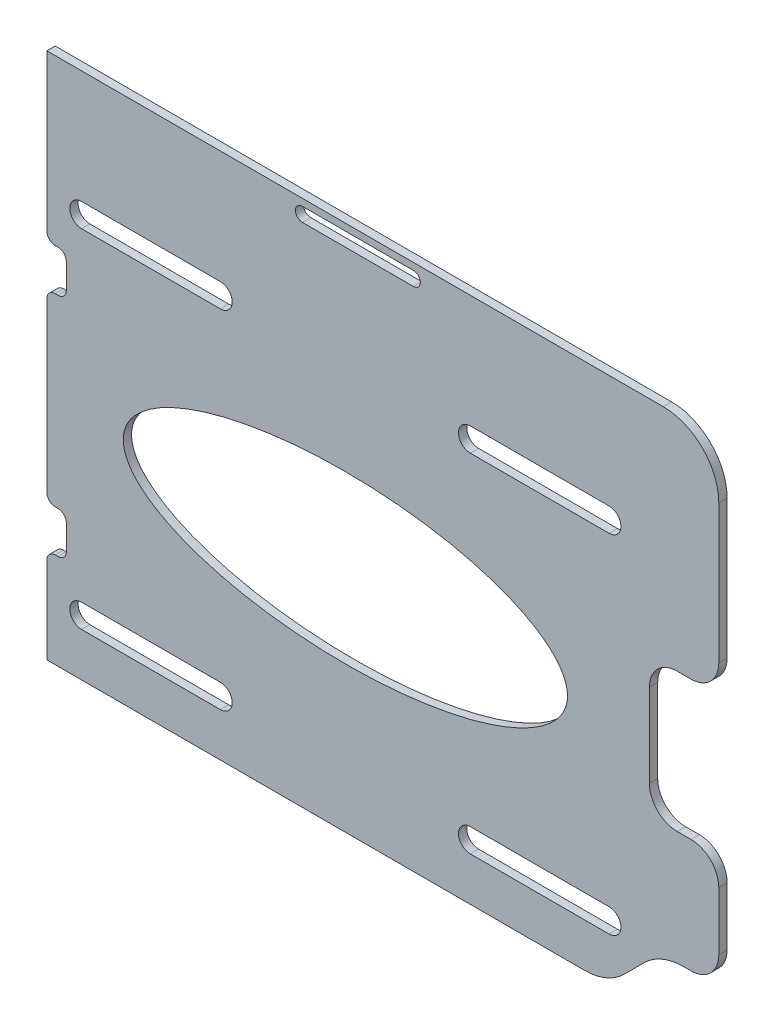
SolidWorks part; units mm, degrees
ref_plane "Plan1" through (0, 0, 0) normal (0, 0, 1) x (1, 0, 0)
ref_plane "Plan2" through (0, 0, 0) normal (0, 1, 0) x (1, 0, 0)
ref_plane "Plan3" through (0, 0, 0) normal (1, 0, 0) x (0, 0, -1)
sketch "Esquisse1" plane through (0, 0, 0) normal (0, 0, 1) x (1, 0, 0)
  line L0 (-95, 66.75) -> (-45, 66.75)
  line L1 (114.5, 107.5) -> (-107.5, 107.5)
  line L2 (-107.5, 107.5) -> (-107.5, 51.25)
  line L3 (-107.5, -82.5) -> (86.2157, -82.5)
  line L4 (134.5, 87.5) -> (134.5, 37.5)
  line L5 (-95, 58.25) -> (-45, 58.25)
  line L6 (45, 66.75) -> (95, 66.75)
  line L7 (45, 58.25) -> (95, 58.25)
  line L8 (-95, -58.25) -> (-45, -58.25)
  line L9 (-95, -66.75) -> (-45, -66.75)
  line L10 (45, -66.75) -> (95, -66.75)
  line L11 (45, -58.25) -> (95, -58.25)
  line L12 (-82.5, 84.25) -> (-82.5, 54.25) construction
  line L13 (-57.5, 84.25) -> (-57.5, 54.25) construction
  line L14 (57.5, 84.25) -> (57.5, 54.25) construction
  line L15 (82.5, 84.25) -> (82.5, 54.25) construction
  line L16 (100.3579, -76.6421) -> (107.6421, -69.3579)
  line L17 (109.5, 17.5) -> (109.5, -12.5)
  line L18 (119.5, 27.5) -> (124.5, 27.5)
  line L19 (119.5, -22.5) -> (124.5, -22.5)
  line L20 (-100.5, -45.25) -> (-100.5, -36.25)
  line L21 (121.7843, -63.5) -> (124.5, -63.5)
  line L22 (134.5, -53.5) -> (134.5, -32.5)
  line L23 (-100.5, 36.25) -> (-100.5, 45.25)
  line L24 (-103.5, 48.25) -> (-104.5, 48.25)
  line L25 (-103.5, 33.25) -> (-104.5, 33.25)
  line L26 (-103.5, -33.25) -> (-104.5, -33.25)
  line L27 (-103.5, -48.25) -> (-104.5, -48.25)
  line L28 (-107.5, 30.25) -> (-107.5, -30.25)
  line L29 (-107.5, -51.25) -> (-107.5, -82.5)
  line L30 (-15.5, 100) -> (24.5, 100)
  line L31 (-15.5, 105) -> (24.5, 105)
  arc A0 (-95, 66.75) -> (-95, 58.25) centre (-95, 62.5) ccw
  arc A1 (-45, 58.25) -> (-45, 66.75) centre (-45, 62.5) ccw
  arc A2 (45, 66.75) -> (45, 58.25) centre (45, 62.5) ccw
  arc A3 (95, 58.25) -> (95, 66.75) centre (95, 62.5) ccw
  arc A4 (-95, -58.25) -> (-95, -66.75) centre (-95, -62.5) ccw
  arc A5 (-45, -66.75) -> (-45, -58.25) centre (-45, -62.5) ccw
  arc A6 (45, -58.25) -> (45, -66.75) centre (45, -62.5) ccw
  arc A7 (95, -66.75) -> (95, -58.25) centre (95, -62.5) ccw
  arc A8 (100.3579, -76.6421) -> (86.2157, -82.5) centre (86.2157, -62.5) cw
  arc A9 (107.6421, -69.3579) -> (121.7843, -63.5) centre (121.7843, -83.5) cw
  arc A10 (134.5, 87.5) -> (114.5, 107.5) centre (114.5, 87.5) ccw
  arc A11 (109.5, 17.5) -> (119.5, 27.5) centre (119.5, 17.5) cw
  arc A12 (119.5, -22.5) -> (109.5, -12.5) centre (119.5, -12.5) cw
  arc A13 (134.5, -32.5) -> (124.5, -22.5) centre (124.5, -32.5) ccw
  arc A14 (134.5, 37.5) -> (124.5, 27.5) centre (124.5, 37.5) cw
  arc A15 (124.5, -63.5) -> (134.5, -53.5) centre (124.5, -53.5) ccw
  arc A16 (-104.5, -33.25) -> (-107.5, -30.25) centre (-104.5, -30.25) cw
  arc A17 (-100.5, -36.25) -> (-103.5, -33.25) centre (-103.5, -36.25) ccw
  arc A18 (-103.5, -48.25) -> (-100.5, -45.25) centre (-103.5, -45.25) ccw
  arc A19 (-107.5, -51.25) -> (-104.5, -48.25) centre (-104.5, -51.25) cw
  arc A20 (-107.5, 30.25) -> (-104.5, 33.25) centre (-104.5, 30.25) cw
  arc A21 (-100.5, 36.25) -> (-103.5, 33.25) centre (-103.5, 36.25) cw
  arc A22 (-103.5, 48.25) -> (-100.5, 45.25) centre (-103.5, 45.25) cw
  arc A23 (-104.5, 48.25) -> (-107.5, 51.25) centre (-104.5, 51.25) cw
  arc A24 (-15.5, 105) -> (-15.5, 100) centre (-15.5, 102.5) ccw
  arc A25 (24.5, 100) -> (24.5, 105) centre (24.5, 102.5) ccw
  ellipse E0 centre (0, 0) end of major axis (-80, 0) minor radius 30
  point P46 (94.5, -82.5)
  point P49 (134.5, -42.5)
  point P52 (132.5, 107.5)
  point P63 (113.5, -63.5)
  point P71 (134.5, -63.5)
  point P80 (-107.5, -33.25)
  point P83 (-100.5, -33.25)
  point P86 (-100.5, -48.25)
  point P89 (-107.5, -48.25)
  point P92 (-107.5, 33.25)
  dimension "D5" = 4.25
  dimension "D19" = 20
  dimension "D20" = 20
  dimension "D22" = 10
  dimension "D25" = 10
  dimension "D27" = 20
  dimension "D28" = 10
  dimension "D33" = 3
  dimension "D34" = 5
  dimension "D1" = 240
  dimension "D2" = 45
  dimension "D3" = 190
  dimension "D4" = 62.5
  dimension "D6" = 25
  dimension "D7" = 25
  dimension "D8" = 140
  dimension "D9" = 125
  dimension "D10" = 50
  dimension "D11" = 50
  dimension "D12" = 12.5
  dimension "D13" = 140
  dimension "D14" = 40
  dimension "D15" = 60
  dimension "D16" = 160
  dimension "D17" = 20
  dimension "D18" = 40
  dimension "D21" = 25
  dimension "D23" = 50
  dimension "D24" = 60
  dimension "D26" = 21
  dimension "D29" = 15
  dimension "D30" = 10
  dimension "D31" = 10
  dimension "D32" = 7
  dimension "D35" = 40
  dimension "D36" = 5
  dimension "D37" = 110
extrude "Base-Extrusion" add sketch "Esquisse1" along normal blind 3
